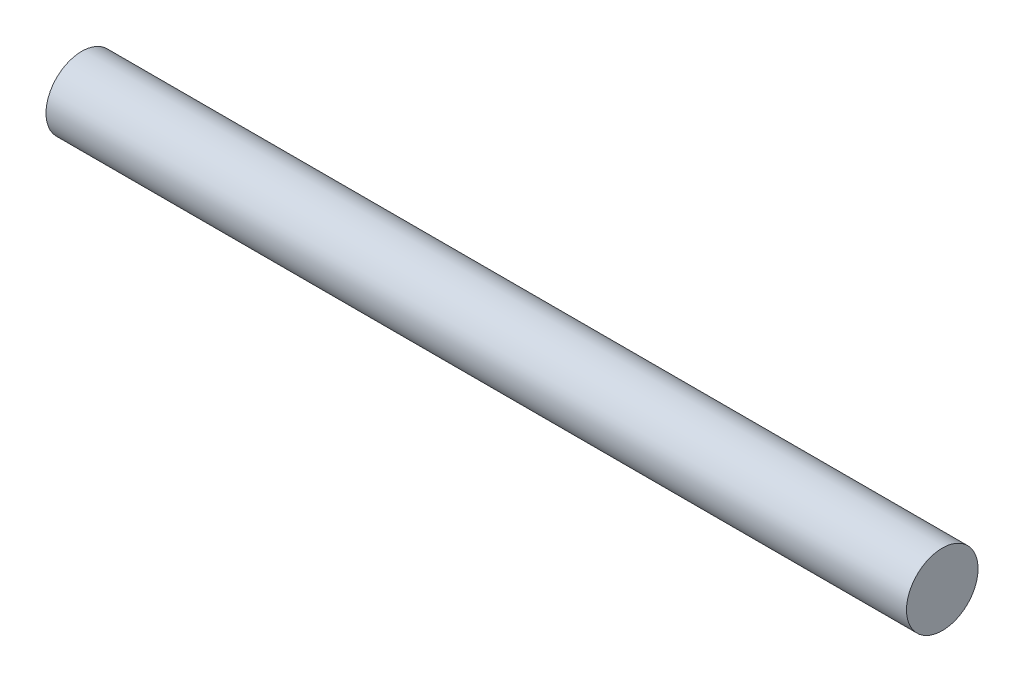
SolidWorks part; units mm, degrees
ref_plane "Front Plane" through (0, 0, 0) normal (0, 0, 1) x (1, 0, 0)
ref_plane "Top Plane" through (0, 0, 0) normal (0, 1, 0) x (1, 0, 0)
ref_plane "Right Plane" through (0, 0, 0) normal (1, 0, 0) x (0, 0, -1)
sketch "Sketch1" plane through (0, 0, 0) normal (0, 0, 1) x (1, 0, 0)
  line L0 (0, 0) -> (0, 3.2004)
  line L1 (0, 3.2004) -> (76.962, 3.2004)
  line L2 (76.962, 3.2004) -> (76.962, 0)
  line L3 (76.962, 0) -> (0, 0)
  line L4 (76.962, 0) -> (0, 0) construction
revolve "Revolve1" add sketch "Sketch1" angle 360 about L4
ref_plane "Plane1" through (9.906, 0, 0) normal (1, 0, 0) x (0, 0, -1)
